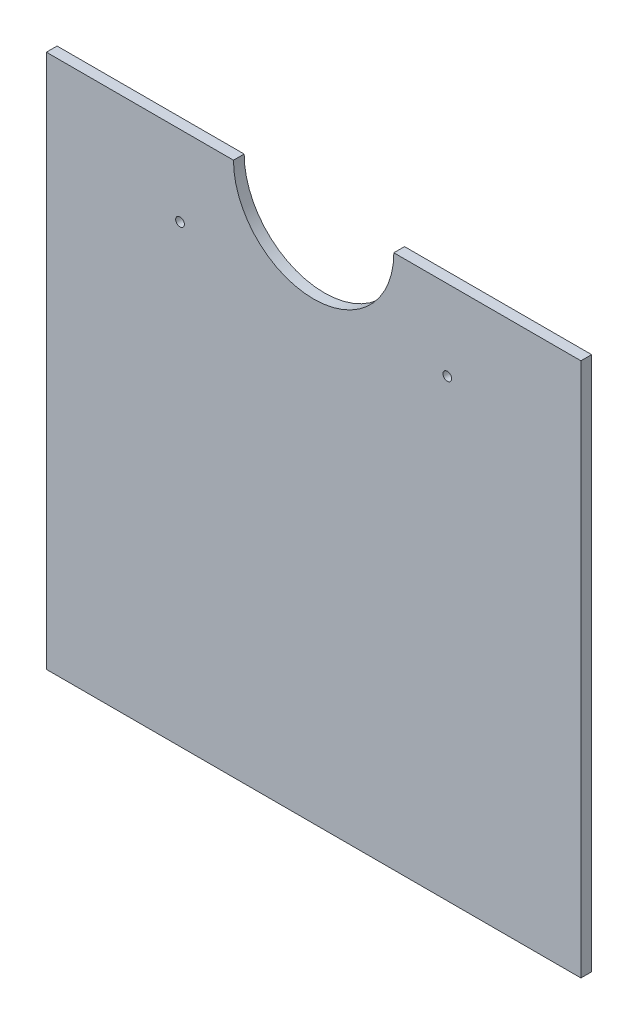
SolidWorks part; units mm, degrees
ref_plane "Plan1" through (0, 0, 0) normal (0, 0, 1) x (1, 0, 0)
ref_plane "Plan2" through (0, 0, 0) normal (0, 1, 0) x (1, 0, 0)
ref_plane "Plan3" through (0, 0, 0) normal (1, 0, 0) x (0, 0, -1)
sketch "Esquisse1" plane through (0, 0, 0) normal (0, 0, 1) x (1, 0, 0)
  line L0 (260, 480) -> (400, 480)
  line L1 (0, 80) -> (400, 80)
  line L2 (0, 80) -> (0, 480)
  line L3 (0, 480) -> (140, 480)
  line L4 (400, 80) -> (400, 480)
  line L5 (200, 80) -> (200, 530) construction
  arc A0 (140, 480) -> (260, 480) centre (200, 480) ccw
  dimension "D3" = 60
  dimension "D1" = 400
  dimension "D2" = 400
extrude "Base-Extrusion" add sketch "Esquisse1" along normal blind 8
sketch "Esquisse2" plane through (0, 0, 8) normal (0, 0, 1) x (1, 0, 0)
  line L0 (200, 500) -> (200, 80) construction
  line L2 (0, 80) -> (400, 80) construction
  circle A0 centre (100, 420) radius 3.25
  circle A1 centre (300, 420) radius 3.25
  dimension "D3" = 6.5
  dimension "D1" = 200
  dimension "D2" = 340
extrude "Enlèv. mat.-Extru.1" cut sketch "Esquisse2" against normal through all
